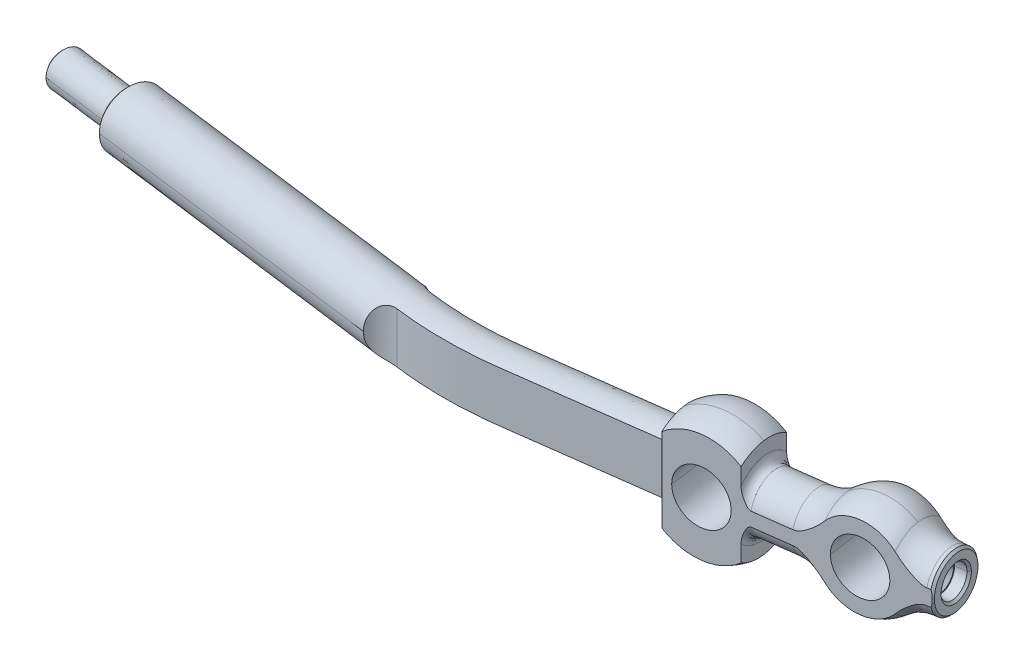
SolidWorks part; units mm, degrees
ref_plane "Ebene oben" through (0, 0, 0) normal (0, 0, 1) x (1, 0, 0)
ref_plane "Ebene vorne" through (0, 0, 0) normal (0, 1, 0) x (1, 0, 0)
ref_plane "Ebene rechts" through (0, 0, 0) normal (1, 0, 0) x (0, 0, -1)
sketch "Skizze1" plane through (0, 0, 0) normal (0, 0, 1) x (1, 0, 0)
  line L0 (0, 100) -> (0, 0) construction
  line L1 (0, 0) -> (100, 0) construction
  line L2 (8, 11.1831) -> (8, 8.2)
  line L3 (10, 6.2) -> (18.4808, 6.2)
  line L4 (-8, 11.1831) -> (-8, 8.7)
  line L5 (-10, 6.7) -> (-139.5, 6.7)
  line L6 (0, 0) -> (-169.195, 0) construction
  line L7 (-139.5, 6.7) -> (-139.5, 4.5)
  line L8 (-140, 4) -> (-157, 4)
  line L9 (-157, 4) -> (-157, 0)
  line L10 (-157, 0) -> (46.8, 0)
  line L11 (45.4591, 6.25) -> (46.8, 6.25)
  line L12 (46.8, 6.25) -> (46.8, 0)
  circle A0 centre (0, 0) radius 6 construction
  arc A1 (-8, 11.1831) -> (8, 11.1831) centre (0, 0) cw
  arc A2 (8, 8.2) -> (10, 6.2) centre (10, 8.2) ccw
  arc A3 (-8, 8.7) -> (-10, 6.7) centre (-10, 8.7) cw
  circle A4 centre (32, 0) radius 6 construction
  arc A5 (24.888, 8.5223) -> (39.0804, 8.5486) centre (32, 0) cw
  arc A6 (18.4808, 6.2) -> (24.888, 8.5223) centre (18.4808, 16.2) ccw
  arc A7 (39.0804, 8.5486) -> (45.4591, 6.25) centre (45.4591, 16.25) ccw
  arc A8 (-139.5, 4.5) -> (-140, 4) centre (-140, 4.5) cw
  point P30 (-139.5, 4)
  dimension "D1" = 12
  dimension "D3" = 27.5
  dimension "D4" = 2
  dimension "D6" = 2
  dimension "D11" = 12
  dimension "D12" = 10
  dimension "D14" = 22.2
  dimension "D15" = 32
  dimension "D16" = 14.8
  dimension "D18" = 0.5
  dimension "D2" = 12.4
  dimension "D5" = 16
  dimension "D7" = 13.4
  dimension "D8" = 157
  dimension "D9" = 17.5
  dimension "D10" = 8
  dimension "D13" = 12.5
  dimension "D17" = 46.8
revolve "Rotation1" add sketch "Skizze1" angle 360 about L1
chamfer "Fase1" distance 0.5 angle 45
sketch "Skizze3" plane through (0, 0, 0) normal (0, 0, 1) x (1, 0, 0)
  circle A0 centre (32, 0) radius 6 construction
  circle A1 centre (0, 0) radius 6 construction
  circle A2 centre (32, 0) radius 6
  circle A3 centre (0, 0) radius 6
extrude "Schnitt-Linear austragen1" cut sketch "Skizze3" against normal mid plane 30
sketch "Skizze4" plane through (0, 0, 0) normal (0, 1, 0) x (1, 0, 0)
  line L0 (0, 0) -> (65.6471, 0) construction
  line L1 (0, 0) -> (-166.0086, 0) construction
  line L2 (-8, 11.1831) -> (-8, -11.1831) construction
  line L3 (-69.6648, 16) -> (50, 16)
  line L4 (-8, 6) -> (-8, 5.5)
  line L5 (-8, 6) -> (50, 6)
  line L6 (50, 16) -> (50, 6)
  line L7 (-10, 3.5) -> (-65, 3.5)
  line L8 (-10, 6.7) -> (-139, 6.7) construction
  line L9 (-69.6648, 6.7) -> (-69.6648, 16)
  line L10 (-69.6648, -16) -> (50, -16)
  line L11 (-69.6648, -6.7) -> (-69.6648, -16)
  line L12 (-10, -3.5) -> (-65, -3.5)
  line L13 (-8, -6) -> (-8, -5.5)
  line L14 (-8, -6) -> (50, -6)
  line L15 (50, -16) -> (50, -6)
  arc A0 (-65, 3.5) -> (-69.6648, 6.7) centre (-65, 8.5) cw
  arc A1 (-65, -3.5) -> (-69.6648, -6.7) centre (-65, -8.5) ccw
  arc A2 (-8, 5.5) -> (-10, 3.5) centre (-10, 5.5) cw
  arc A3 (-10, -3.5) -> (-8, -5.5) centre (-10, -5.5) cw
  point P26 (-8, 3.5)
  point P29 (-8, -3.5)
  dimension "D3" = 2
  dimension "D7" = 5
  dimension "D1" = 12
  dimension "D2" = 7
  dimension "D4" = 10
  dimension "D5" = 50
  dimension "D8" = 65
extrude "Schnitt-Linear austragen2" cut sketch "Skizze4" against normal mid plane 30
sketch "Skizze5" plane through (46.8, 0, 0) normal (1, 0, 0) x (0, 0, -1)
  circle A0 centre (0, 0) radius 3.5
  dimension "D1" = 7
extrude "Schnitt-Linear austragen3" cut sketch "Skizze5" against normal blind 3
chamfer "Fase2" distance 0.5 angle 45
hole_wizard "M6 Gewindekernloch1" positions "3D-Skizze1" profile "Skizze6" tap size "M6" standard "DIN"
sketch3d "3D-Skizze1"
  circle A0 centre (43.8, 0, 0) radius 3.5 construction
  point P0 (43.8, 0, 0)
  point P5 (47.3, 0, 0)
sketch "Skizze6" plane through (43.8, 0, 0) normal (0, 1, 0) x (0, 0, -1)
  line L0 (0, 0) -> (0, 5.8)
  line L1 (0, 5.8) -> (2.5, 5.8)
  line L2 (2.5, 5.8) -> (2.5, 0.75)
  line L3 (2.5, 0.75) -> (3.25, 0)
  line L5 (3.25, 0) -> (0, 0)
  line L6 (-2.5, 0.75) -> (-3.25, 0) construction
  line L11 (0, -6.35) -> (0, 107.95) construction
  dimension "Bohrerdurchmesser" = 5
  dimension "Bohrungstiefe" = 5.8
  dimension "Senkdurchmesser (Oben)" = 6.5
  dimension "Senkwinkel (Oben)" = 90
sketch "Position" plane through (-157, 1.677, 1.5221) normal (-1, 0, 0) x (0, 0, 1)
  line L0 (-5.0757, -1.677) -> (-1.5221, -1.677) construction
  line L1 (-1.5221, -1.677) -> (-1.5221, -5.2307) construction
  circle A0 centre (-1.5221, -1.677) radius 4 construction
ref_plane "Ebene1" through (-157, 0, 0) normal (0, -1, 0) x (1, 0, 0)
sketch "Skizze33" plane through (-157, 0, 0) normal (0, -1, 0) x (0, 0, 1)
  line L0 (0, 0) -> (0, -4.7988) construction
  line L2 (0, -3.3807) -> (0.8, -2.9)
  line L3 (0.8, -2.9) -> (0.8, -1.5155)
  line L4 (0.8, -1.5155) -> (1.675, 0)
  line L5 (1.675, 0) -> (0, 0)
  line L6 (0, 0) -> (0, -3.3807)
  dimension "D1" = 30
  dimension "D2" = 59
  dimension "D3" = 1.6
  dimension "D4" = 3.35
  dimension "D5" = 2.9
revolve "Schnitt-Rotation1" cut sketch "Skizze33" angle 360 about L0
other "DIN 332 - A 1,6 x 3,35<1>"
sketch "Skizze34" plane through (0, 0, 0) normal (0, 0, 1) x (1, 0, 0)
  line L0 (-54, 20.0736) -> (-54, -20.778)
  dimension "D1" = 54
other "Verbiegen1" parameters "D0"=15, "D1"=92.2233, "D2"=89.7315
